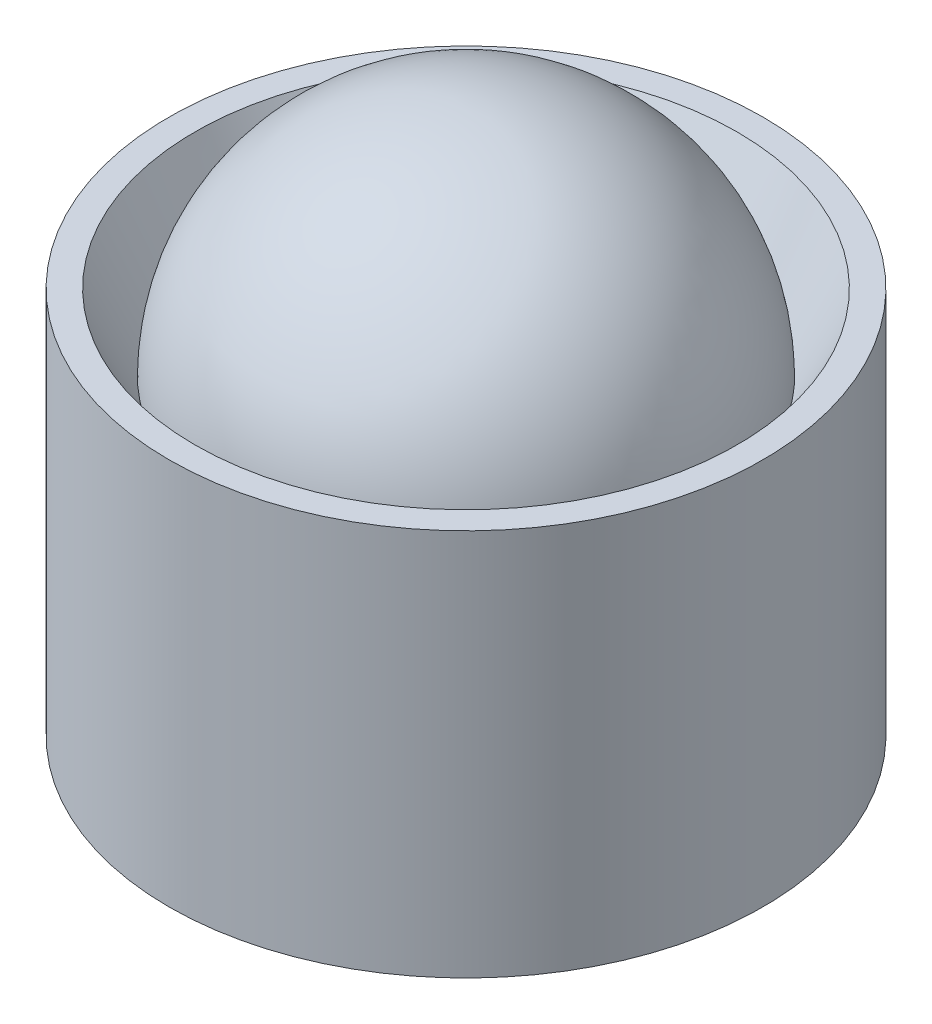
SolidWorks part; units mm, degrees
ref_plane "Front Plane" through (0, 0, 0) normal (0, 0, 1) x (1, 0, 0)
ref_plane "Top Plane" through (0, 0, 0) normal (0, 1, 0) x (1, 0, 0)
ref_plane "Right Plane" through (0, 0, 0) normal (1, 0, 0) x (0, 0, -1)
sketch "Sketch1" plane through (0, 0, 0) normal (0, 1, 0) x (1, 0, 0)
  circle A0 centre (0, 0) radius 11.5
  circle A1 centre (0, 0) radius 5.5
  circle A2 centre (7.5, 0) radius 1.25
  circle A3 centre (-7.5, 0) radius 1.25
  dimension "D1" = 23
  dimension "D2" = 11
  dimension "D3" = 2.5
  dimension "D4" = 2.5
  dimension "D5" = 7.5
  dimension "D6" = 7.5
extrude "Boss-Extrude1" add sketch "Sketch1" along normal blind 15
chamfer "Chamfer1" distance 5 distance2 10 1 edges at (0, 15, 5.5)
ref_plane "Plane1" through (0, 21, 0) normal (0, -1, 0) x (-1, 0, 0)
ref_plane "Plane2" through (0, 12, 0) normal (0, -1, 0) x (-1, 0, 0)
sketch "Sketch2" plane through (0, 12, 0) normal (0, -1, 0) x (-1, 0, 0)
  circle A0 centre (0, 0) radius 9
  dimension "D1" = 18
extrude "Boss-Extrude2" add sketch "Sketch2" along normal mid plane 18 separate body
fillet "Fillet1" radius 9 2 edges at (0, 21, -9) (0, 3, -9)
